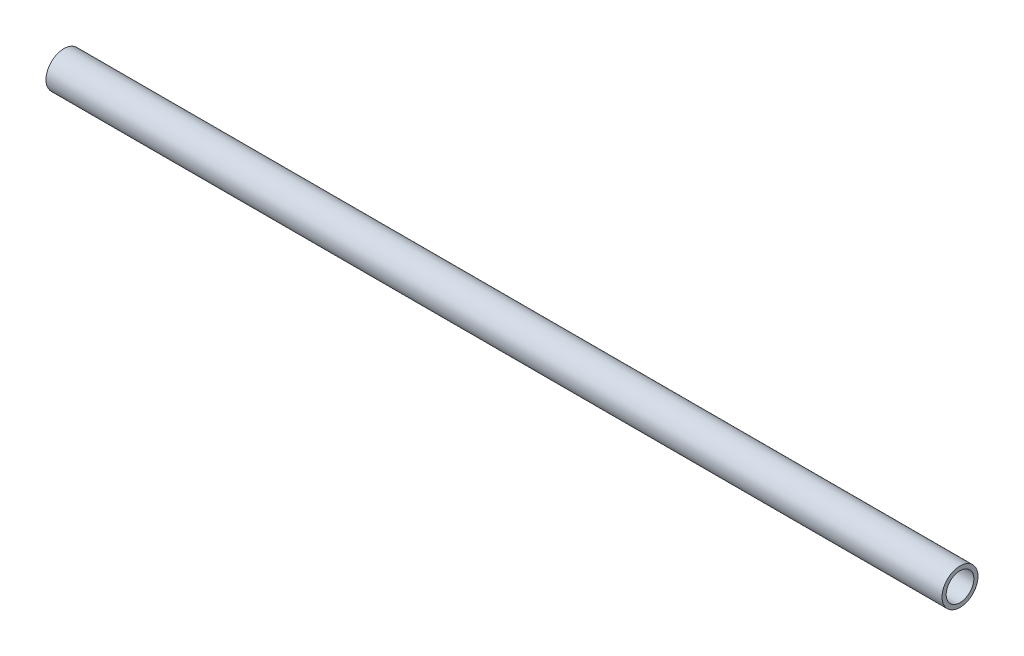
SolidWorks part; units mm, degrees
ref_plane "Front" through (0, 0, 0) normal (0, 0, 1) x (1, 0, 0)
ref_plane "Top" through (0, 0, 0) normal (0, 1, 0) x (1, 0, 0)
ref_plane "Right" through (0, 0, 0) normal (1, 0, 0) x (0, 0, -1)
sketch "Sketch1" plane through (0, 0, 0) normal (0, 0, 1) x (1, 0, 0)
  line L0 (0, 0) -> (822.325, 0)
  line L1 (9.9848, 0) -> (-9.9848, 0) construction
  dimension "D1" = 822.325
other "Structural Member1"
ref_plane "Plane1" through (0, 0, 0) normal (1, 0, 0) x (0, 0, -1)
sketch "Sketch11" plane through (0, 0, 0) normal (1, 0, 0) x (0, 0, -1)
  circle A0 centre (0, 0) radius 12.7
  circle A1 centre (0, 0) radius 16.51
  point P3 (0, 0)
  dimension "D1" = 33.02
  dimension "D2" = 25.4
